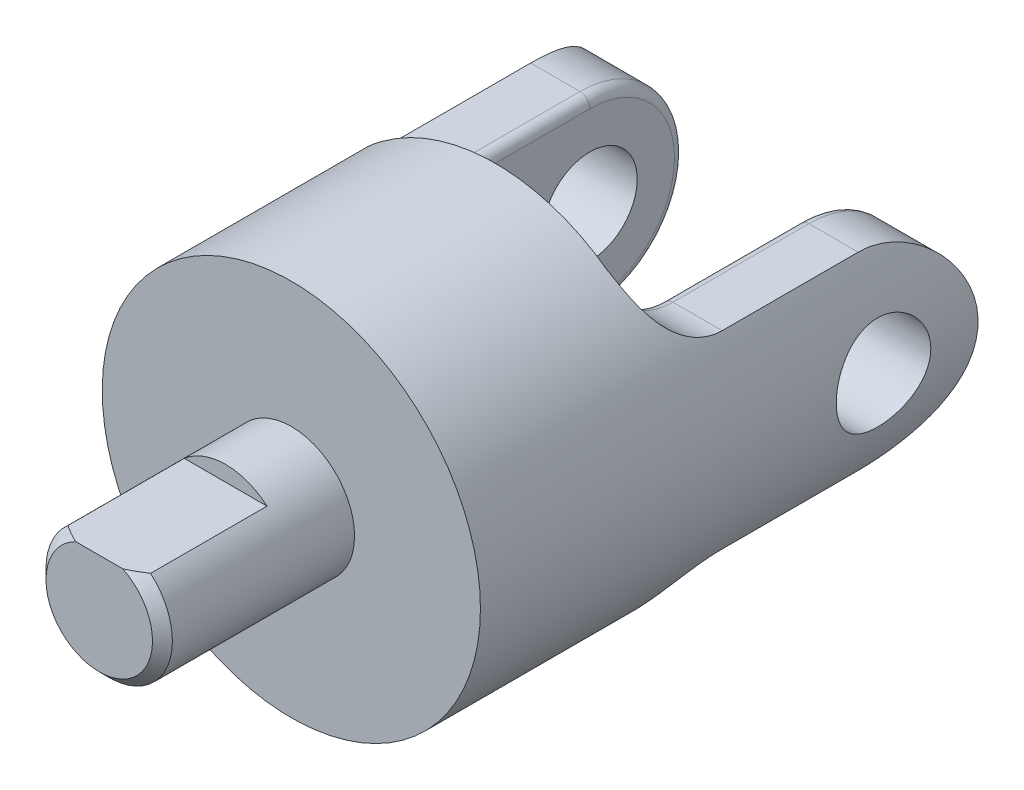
SolidWorks part; units mm, degrees
ref_plane "Ebene vorne" through (0, 0, 0) normal (0, 0, 1) x (1, 0, 0)
ref_plane "Ebene oben" through (0, 0, 0) normal (0, 1, 0) x (1, 0, 0)
ref_plane "Ebene rechts" through (0, 0, 0) normal (1, 0, 0) x (0, 0, -1)
sketch "Skizze1" plane through (0, 0, 0) normal (0, 0, 1) x (1, 0, 0)
  circle A0 centre (0, 0) radius 19
  dimension "D1" = 38
extrude "Linear austragen1" add sketch "Skizze1" along normal blind 50
sketch "Skizze4" plane through (0, 0, 0) normal (0, 1, 0) x (1, 0, 0)
  line L0 (0, -102.3606) -> (0, 17.9778) construction
  line L1 (19, 0) -> (-19, 0) construction
  line L2 (-10.5, 0) -> (10.5, 0)
  line L3 (-10.5, 0) -> (-10.5, -29.5)
  line L4 (-10.5, -29.5) -> (10.5, -29.5)
  line L5 (10.5, 0) -> (10.5, -29.5)
  dimension "D1" = 21
  dimension "D2" = 29.5
extrude "Linear austragen4" cut sketch "Skizze4" against normal mid plane 100
sketch "Skizze5" plane through (0, 0, 0) normal (1, 0, 0) x (0, 0, -1)
  line L0 (0, 0) -> (-28.5916, 0) construction
  circle A0 centre (-9.5, 0) radius 4.75
  dimension "D1" = 9.5
  dimension "D2" = 9.5
extrude "Linear austragen5" cut sketch "Skizze5" against normal mid plane 100
sketch "Skizze6" plane through (0, 0, 0) normal (1, 0, 0) x (0, 0, -1)
  line L0 (-29.5, 15.8351) -> (-29.5, 19) construction
  line L1 (0, 15.8351) -> (-29.5, 15.8351) construction
  line L2 (-23.1649, 9.5) -> (-9.5, 9.5)
  line L3 (-29.5, 15.8351) -> (-29.5, 19)
  line L4 (18.6327, 0) -> (-89.9628, 0) construction
  line L5 (-29.5, 19) -> (0, 19)
  line L6 (0, 19) -> (0, 0)
  arc A0 (-29.5, 15.8351) -> (-23.1649, 9.5) centre (-23.1649, 15.8351) ccw
  arc A1 (0, 0) -> (-9.5, 9.5) centre (-9.5, 0) ccw
extrude "Linear austragen6" cut sketch "Skizze6" against normal mid plane 100
mirror "Spiegeln1" about plane through (0, 0, 0) normal (0, 1, 0) of "Linear austragen6"
sketch "Skizze7" plane through (0, 0, 50) normal (0, 0, 1) x (1, 0, 0)
  circle A0 centre (0, 0) radius 6.35
  dimension "D1" = 12.7
extrude "Linear austragen7" add sketch "Skizze7" along normal blind 19.3
chamfer "Fase1" distance 1 angle 45 1 edges at (6.35, 0, 69.3)
sketch "Skizze8" plane through (0, 0, 69.3) normal (0, 0, 1) x (1, 0, 0)
  line L0 (-4.1572, 4.8) -> (4.1572, 4.8)
  circle A0 centre (0, 0) radius 6.35 construction
  arc A1 (4.1572, 4.8) -> (-4.1572, 4.8) centre (0, 0) ccw
  circle A5 centre (0, 0) radius 6.35 construction
  dimension "D1" = 11.15
extrude "Linear austragen8" cut sketch "Skizze8" against normal blind 12.7
fillet "Verrundung1" radius 1 10 edges at (-10.5, -11.3555, 27.6445) (-10.5, -9.5, 16.3325) (-10.5, 0, 0) (-10.5, 11.3555, 27.6445) (10.5, 11.3555, 27.6445) (10.5, -11.3555, 27.6445) (10.5, -9.5, 16.3325) (10.5, 0, 0) (-10.5, 9.5, 16.3325) (10.5, 9.5, 16.3325)
